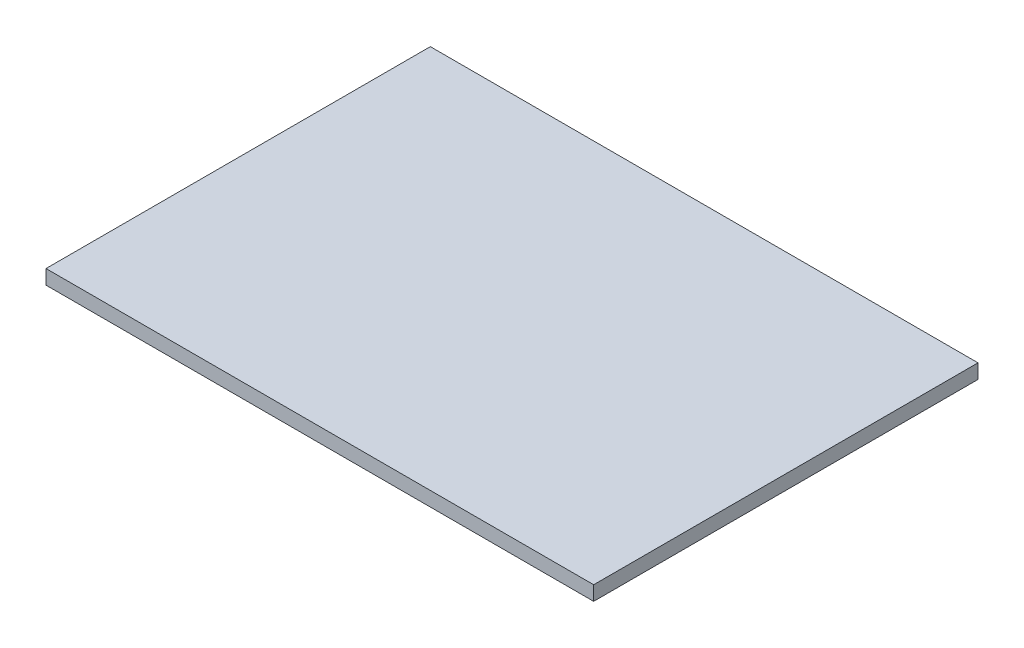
SolidWorks part; units mm, degrees
ref_plane "Front Plane" through (0, 0, 0) normal (0, 0, 1) x (1, 0, 0)
ref_plane "Top Plane" through (0, 0, 0) normal (0, 1, 0) x (1, 0, 0)
ref_plane "Right Plane" through (0, 0, 0) normal (1, 0, 0) x (0, 0, -1)
sketch "Sketch1" plane through (0, 0, 0) normal (0, 1, 0) x (1, 0, 0)
  line L1 (0, 0) -> (180.975, 0)
  line L2 (0, 0) -> (0, 127)
  line L3 (0, 127) -> (180.975, 127)
  line L4 (180.975, 0) -> (180.975, 127)
  dimension "D1" = 180.975
  dimension "D2" = 127
extrude "Boss-Extrude1" add sketch "Sketch1" along normal blind 4.7625
sketch "Sketch2" plane through (0, 0, 0) normal (0, 0, 1) x (1, 0, 0)
  line L0 (0, 4.7625) -> (180.975, 4.7625) construction
  line L1 (2.54, 4.445) -> (7.62, 4.445)
  line L2 (2.54, 4.445) -> (2.54, 0.3175)
  line L3 (2.54, 0.3175) -> (7.62, 0.3175)
  line L4 (7.62, 4.445) -> (7.62, 0.3175)
  line L5 (0, 0) -> (180.975, 0) construction
  line L8 (0, 4.7625) -> (0, 0) construction
  dimension "D1" = 0.3175
  dimension "D2" = 0.3175
  dimension "D3" = 2.54
  dimension "D4" = 5.08
extrude "Cut-Extrude3" [suppressed] cut sketch "Sketch2" against normal through all
pattern_linear "LPattern1" [suppressed] count 33 spacing 5.3975 count 2 spacing 5.3975
